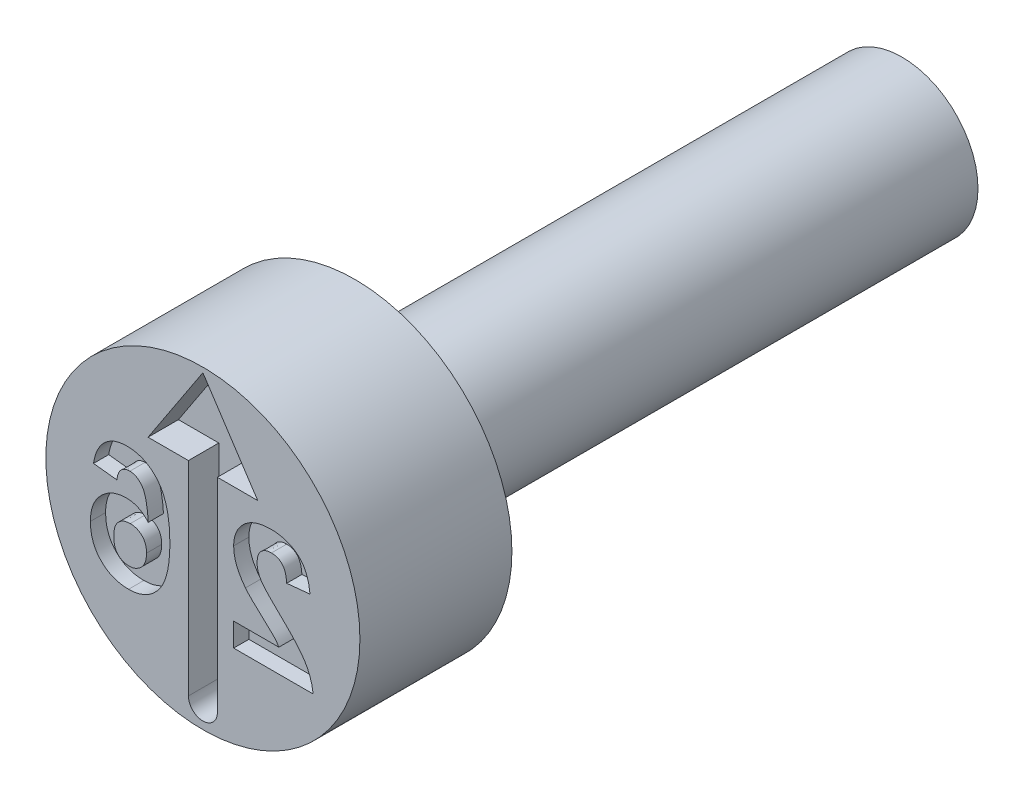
SolidWorks part; units mm, degrees
ref_plane "Front Plane" through (0, 0, 0) normal (0, 0, 1) x (1, 0, 0)
ref_plane "Top Plane" through (0, 0, 0) normal (0, 1, 0) x (1, 0, 0)
ref_plane "Right Plane" through (0, 0, 0) normal (1, 0, 0) x (0, 0, -1)
sketch "Sketch2" plane through (0, 0, 0) normal (1, 0, 0) x (0, 0, -1)
  line L0 (0.4039, 0) -> (50000.4039, 0) construction
  line L6 (0, 3.1) -> (0, 0)
  line L7 (3, 3.1) -> (0, 3.1)
  line L8 (3, 1.5) -> (3, 3.1)
  line L9 (13.8, 1.5) -> (3, 1.5)
  line L10 (13.8, 0) -> (13.8, 1.5)
  line L11 (0, 0) -> (13.8, 0)
  dimension "D1" = 6.2
  dimension "D2" = 3
  dimension "D3" = 13.8
  dimension "D4" = 3
revolve "Revolve1" add sketch "Sketch2" angle 360 about L0
sketch "Sketch3" plane through (0, 0, 0) normal (0, 0, 1) x (1, 0, 0)
  line L0 (0, 0) -> (0, 150000) construction
  line L1 (0.2857, 1.3595) -> (0.2857, -2.6642)
  line L2 (1.0829, 1.3595) -> (0.2857, 1.3595)
  line L3 (0, 3.0032) -> (1.0829, 1.3595)
  line L15 (0, 3.0032) -> (-1.0829, 1.3595)
  line L16 (-1.0829, 1.3595) -> (-0.2857, 1.3595)
  line L17 (-0.2857, 1.3595) -> (-0.2857, -2.6642)
  arc A2 (-0.2857, -2.6642) -> (0.2857, -2.6642) centre (0, -2.6642) ccw
extrude "Cut-Extrude4" cut sketch "Sketch3" against normal blind 0.6
sketch "Sketch4" plane through (0, 0, 0) normal (0, 0, 1) x (1, 0, 0)
  text T0 "2  6" font "Arial" height 2.4
  dimension "D1" = 1.4
  dimension "D2" = 2.3
extrude "Cut-Extrude5" cut sketch "Sketch4" against normal blind 0.3
